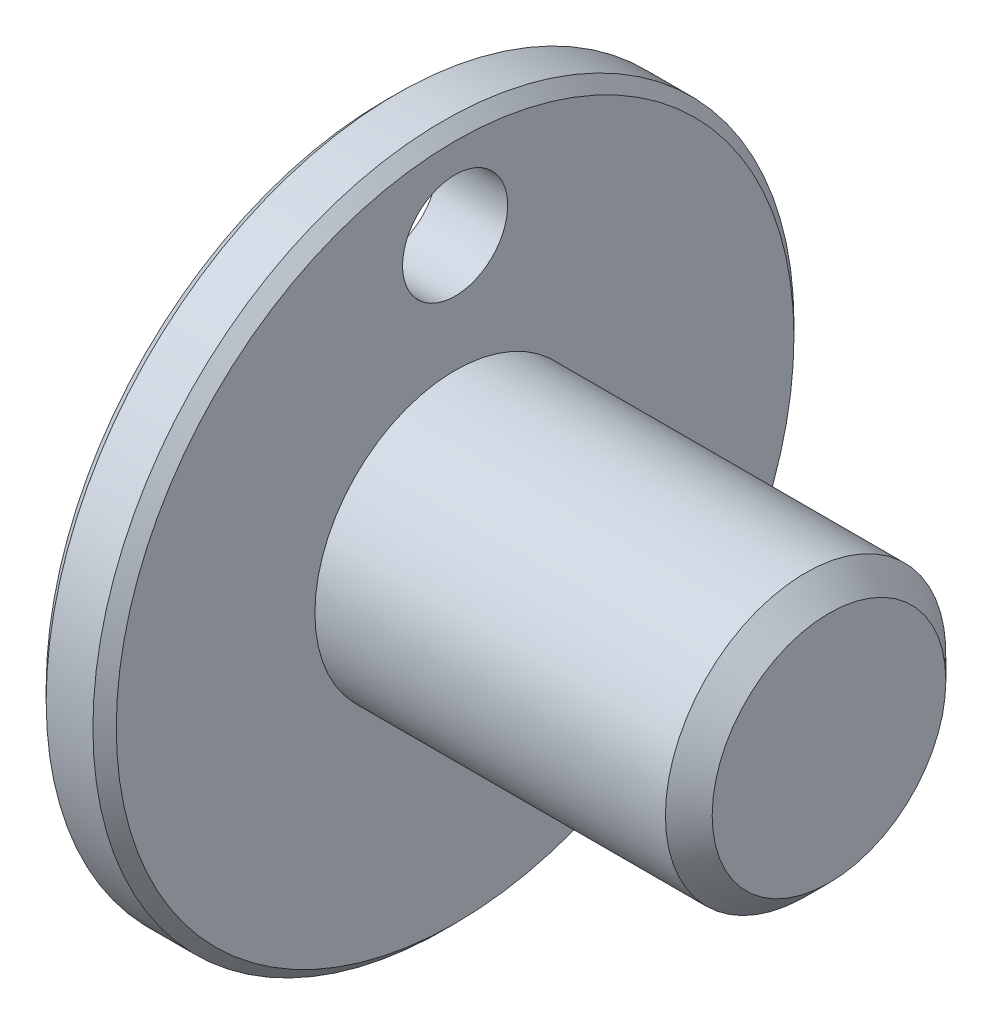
SolidWorks part; units mm, degrees
ref_plane "Face" through (0, 0, 0) normal (0, 0, 1) x (1, 0, 0)
ref_plane "Dessus" through (0, 0, 0) normal (0, 1, 0) x (1, 0, 0)
ref_plane "Droite" through (0, 0, 0) normal (1, 0, 0) x (0, 0, -1)
sketch "Esquisse1" plane through (0, 0, 0) normal (0, 0, 1) x (1, 0, 0)
  line L0 (-27.3367, 0) -> (37.1402, 0) construction
  line L1 (-3, 0) -> (-3, 15)
  line L2 (-3, 15) -> (0, 15)
  line L3 (0, 15) -> (0, 6)
  line L4 (0, 6) -> (16, 6)
  line L5 (16, 6) -> (16, 0)
  line L6 (-3, 0) -> (16, 0)
  dimension "D1" = 16
  dimension "D2" = 19
  dimension "D3" = 15
  dimension "D4" = 6
revolve "Base-Révolution" add sketch "Esquisse1" angle 360 about L0
chamfer "Chanfrein1" distance 1 angle 45 1 edges at (16, 0, 6)
chamfer "Chanfrein2" distance 0.5 angle 45 2 edges at (-3, 0, 15) (0, 0, 15)
sketch "Esquisse2" plane through (-3, 0, 0) normal (-1, 0, 0) x (0, 0, 1)
  line L0 (0, 0) -> (0, 12.8073) construction
  circle A0 centre (0, 11) radius 2.25
  dimension "D1" = 11
  dimension "D2" = 4.5
extrude "Enlèv. mat.-Extru.1" cut sketch "Esquisse2" against normal through all
